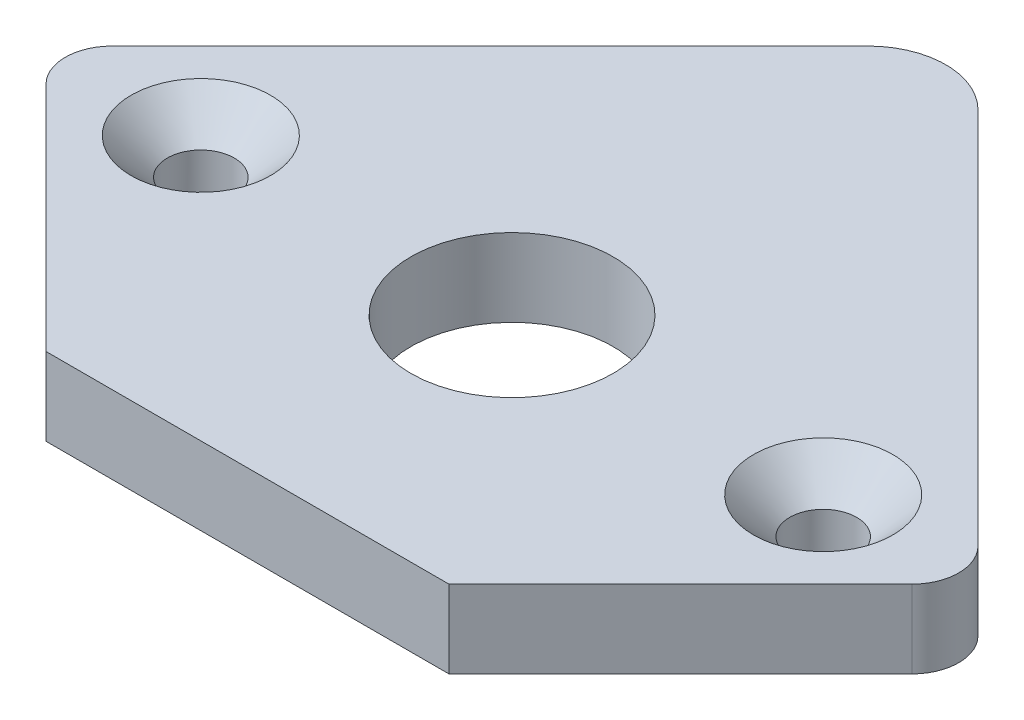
SolidWorks part; units mm, degrees
ref_plane "Front Plane" through (0, 0, 0) normal (0, 0, 1) x (1, 0, 0)
ref_plane "Top Plane" through (0, 0, 0) normal (0, 1, 0) x (1, 0, 0)
ref_plane "Right Plane" through (0, 0, 0) normal (1, 0, 0) x (0, 0, -1)
sketch "Sketch1" plane through (0, 0, 0) normal (0, 1, 0) x (1, 0, 0)
  line L0 (-315.6547, 0) -> (15467.0785, 0) construction
  line L1 (0, -315.6547) -> (0, 15467.0785) construction
  line L2 (12.95, -17) -> (-12.95, -17)
  line L3 (-12.95, -17) -> (-27.8287, -2.1213)
  line L4 (-27.8287, 2.1213) -> (-3.5355, 26.4145)
  line L5 (27.8287, 2.1213) -> (3.5355, 26.4145)
  line L6 (12.95, -17) -> (27.8287, -2.1213)
  circle A0 centre (0, 0) radius 6.5
  arc A1 (-27.8287, -2.1213) -> (-27.8287, 2.1213) centre (-25.7074, 0) cw
  arc A2 (27.8287, 2.1213) -> (27.8287, -2.1213) centre (25.7074, 0) cw
  arc A3 (-3.5355, 26.4145) -> (3.5355, 26.4145) centre (0, 22.8789) cw
  point P13 (0, -17)
  point P15 (-29.95, 0)
  point P18 (29.95, 0)
  point P21 (0, 29.95)
  dimension "D3" = 13
  dimension "D4" = 3
  dimension "D5" = 5
  dimension "D1" = 25.9
  dimension "D2" = 17
extrude "Boss-Extrude1" add sketch "Sketch1" along normal mid plane 5
hole_wizard "CSK for M4 SFHCS1" positions "Sketch2" profile "Sketch3" countersink size "M4" standard "ANSI Metric"
sketch "Sketch2" plane through (0, 2.5, 0) normal (0, 1, 0) x (1, 0, 0)
  point P0 (20, 0)
  point P2 (-20, 0)
  dimension "D1" = 40
  dimension "D2" = 20
sketch "Sketch3" plane through (20, 2.5, 0) normal (1, 0, 0) x (0, 0, 1)
  line L0 (0, 0) -> (0, 12.7919)
  line L1 (0, 12.7919) -> (2.15, 11.5)
  line L2 (2.15, 11.5) -> (2.15, 2.33)
  line L3 (2.15, 2.33) -> (4.48, 0)
  line L5 (4.48, 0) -> (0, 0)
  line L6 (-2.15, 2.33) -> (-4.48, 0) construction
  line L10 (0, 12.7919) -> (-2.15, 11.5) construction
  line L11 (0, -6.35) -> (0, 107.95) construction
  dimension "Hole Dia." = 4.3
  dimension "Hole Depth" = 11.5
  dimension "Near C'Sink Dia." = 8.96
  dimension "Near C'Sink Angle" = 90
  dimension "Drill Angle" = 118
